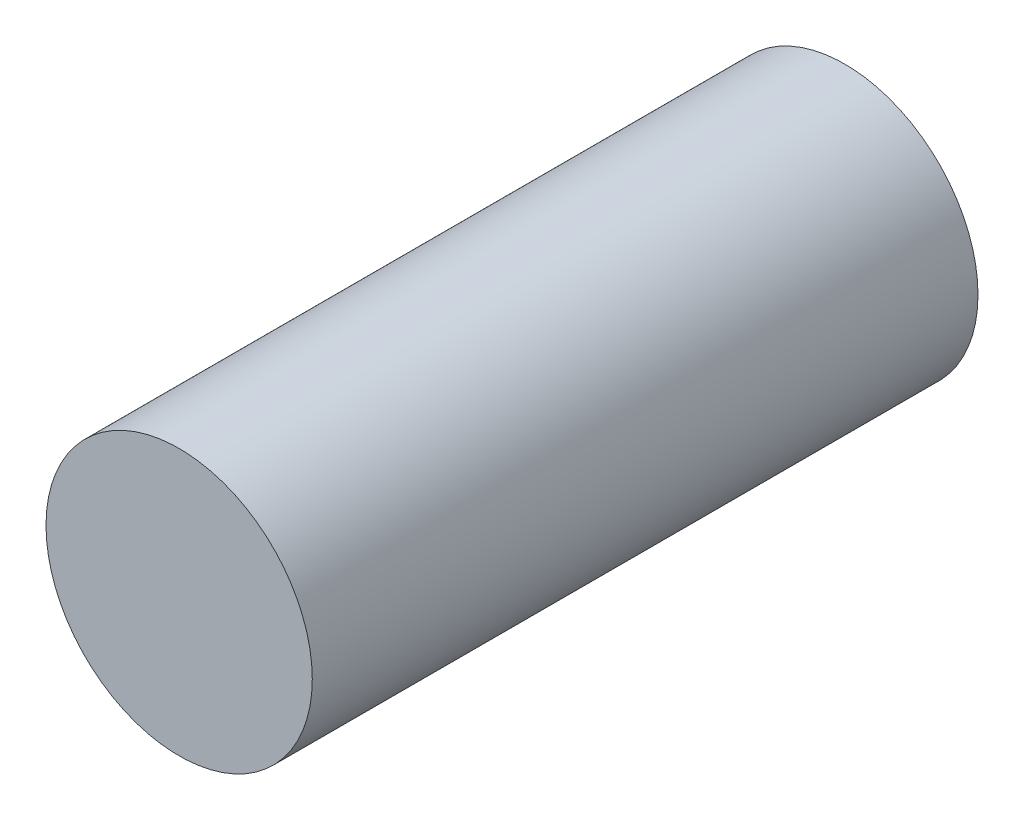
SolidWorks part; units mm, degrees
ref_plane "Płaszczyzna przednia" through (0, 0, 0) normal (0, 0, 1) x (1, 0, 0)
ref_plane "Płaszczyzna górna" through (0, 0, 0) normal (0, 1, 0) x (1, 0, 0)
ref_plane "Płaszczyzna prawa" through (0, 0, 0) normal (1, 0, 0) x (0, 0, -1)
sketch "Szkic1" plane through (0, 0, 0) normal (0, 0, 1) x (1, 0, 0)
  circle A0 centre (0, 0) radius 20
  dimension "D1" = 40
extrude "Dodanie-wyciągnięcie1" add sketch "Szkic1" along normal mid plane 100
